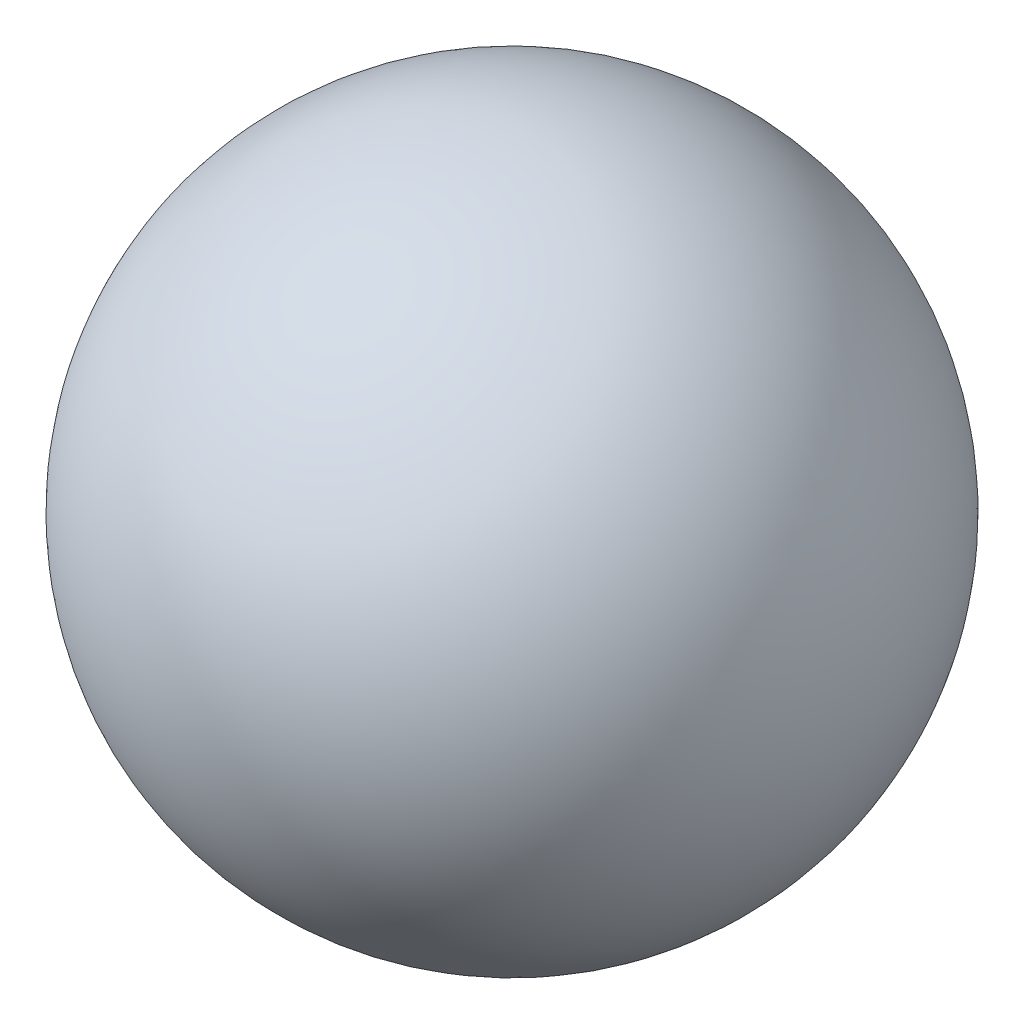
SolidWorks part; units mm, degrees
ref_plane "前视基准面" through (0, 0, 0) normal (0, 0, 1) x (1, 0, 0)
ref_plane "上视基准面" through (0, 0, 0) normal (0, 1, 0) x (1, 0, 0)
ref_plane "右视基准面" through (0, 0, 0) normal (1, 0, 0) x (0, 0, -1)
other "Configuration Table"
sketch "草图1" plane through (0, 0, 0) normal (0, 1, 0) x (1, 0, 0)
  line L0 (-1, 0) -> (1, 0)
  arc A0 (1, 0) -> (-1, 0) centre (0, 0) ccw
  dimension "D1" = 2
revolve "旋转1" add sketch "草图1" angle 360 about L0
